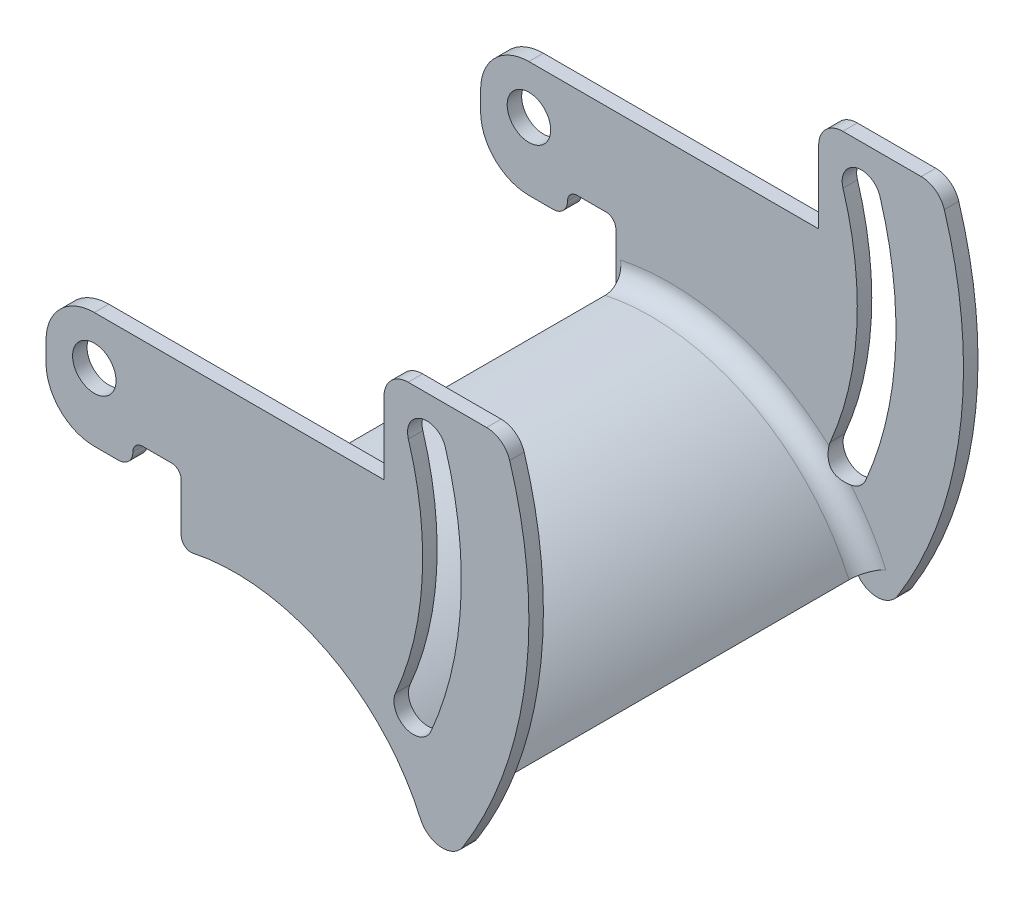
SolidWorks part; units mm, degrees
ref_plane "Plan de face" through (0, 0, 0) normal (0, 0, 1) x (1, 0, 0)
ref_plane "Plan de dessus" through (0, 0, 0) normal (0, 1, 0) x (1, 0, 0)
ref_plane "Plan de droite" through (0, 0, 0) normal (1, 0, 0) x (0, 0, -1)
sketch "Esquisse1" plane through (0, 0, 0) normal (0, 0, 1) x (1, 0, 0)
  line L0 (-24.8528, -20) -> (-84.8528, -20)
  line L1 (-94.8528, -30) -> (-94.8528, -34)
  line L2 (-24.8528, -20) -> (-24.8528, -5)
  line L3 (-19.8528, 0) -> (-3.6124, 0)
  line L4 (-74.8528, -39) -> (-68.8528, -39)
  line L5 (-66.8528, -41) -> (-66.8528, -51)
  line L6 (-84.8528, -44) -> (-79.8528, -44)
  line L7 (-84.8528, -30) -> (-2.4603, -88.4192) construction
  line L8 (-28.275, -80) -> (8.1555, -80) construction
  line L9 (-32.584, -5) -> (-7.2524, -5) construction
  line L10 (-25.1831, -57.1783) -> (-17.3814, -66.6514) construction
  line L11 (-16.8911, -75.1118) -> (-29.6928, -59.5676) construction
  circle A0 centre (-84.8528, -30) radius 4.5
  arc A1 (-84.8528, -44) -> (-94.8528, -34) centre (-84.8528, -34) cw
  arc A2 (-8.5, -77.6471) -> (1.1664, -3.5294) centre (-84.8528, -30) ccw
  arc A3 (-17.3131, -77.0255) -> (-64.4373, -52.9564) centre (-55.7124, -94.0401) ccw
  arc A4 (-84.8528, -20) -> (-94.8528, -30) centre (-84.8528, -30) ccw
  arc A5 (-23.2919, -67.3397) -> (-19.4005, 0) centre (-84.8528, -30) ccw construction
  arc A6 (-15.1254, -60.2339) -> (-12.1573, -7.8333) centre (-84.8528, -30) ccw
  arc A7 (-22.4651, -57.0514) -> (-19.8095, -10.1667) centre (-84.8528, -30) ccw
  arc A8 (-79.8528, -44) -> (-76.8528, -41) centre (-79.8528, -41) ccw
  arc A9 (-74.8528, -39) -> (-76.8528, -41) centre (-74.8528, -41) ccw
  arc A10 (-68.8528, -39) -> (-66.8528, -41) centre (-68.8528, -41) cw
  arc A11 (-66.8528, -51) -> (-64.4373, -52.9564) centre (-64.8528, -51) ccw
  arc A12 (-12.1573, -7.8333) -> (-19.8095, -10.1667) centre (-15.9834, -9) ccw
  arc A13 (-22.4651, -57.0514) -> (-15.1254, -60.2339) centre (-18.7953, -58.6426) ccw
  arc A14 (-8.5, -77.6471) -> (-17.3131, -77.0255) centre (-12.7418, -75) cw
  arc A15 (-24.8528, -5) -> (-19.8528, 0) centre (-19.8528, -5) cw
  arc A16 (-3.6124, 0) -> (1.1664, -3.5294) centre (-3.6124, -5) cw
  point P40 (0, 0)
  dimension "D1" = 84
  dimension "D2" = 10
  dimension "D3" = 180
  dimension "D4" = 144
  dimension "D5" = 4
  dimension "D6" = 4
  dimension "D9" = 10
  dimension "D10" = 2
  dimension "D11" = 2
  dimension "D13" = 5
  dimension "D14" = 5
  dimension "D15" = 9
  dimension "D7" = 20
  dimension "D8" = 60
  dimension "D12" = 24
  dimension "D16" = 18
  dimension "D17" = 28
  dimension "D18" = 10
  dimension "D19" = 19
  dimension "D20" = 80
  dimension "D21" = 5
extrude "Extrusion1" add sketch "Esquisse1" along normal blind 3
sketch "Esquisse2" plane through (0, 0, 3) normal (0, 0, 1) x (1, 0, 0)
  arc A0 (-17.3131, -77.0255) -> (-64.4373, -52.9564) centre (-55.7124, -94.0401) ccw construction
  arc A1 (-17.3131, -77.0255) -> (-64.4373, -52.9564) centre (-55.7124, -94.0401) ccw
extrude "Extru.-Mince1" add sketch "Esquisse2" along normal blind 87 thin
pattern_linear "Répétition linéaire1" count 2 spacing 90 along (0, 0, 1) of "Extrusion1"
fillet "Congé2" radius 4 1 edges at (-35.2435, -53.9649, 3)
